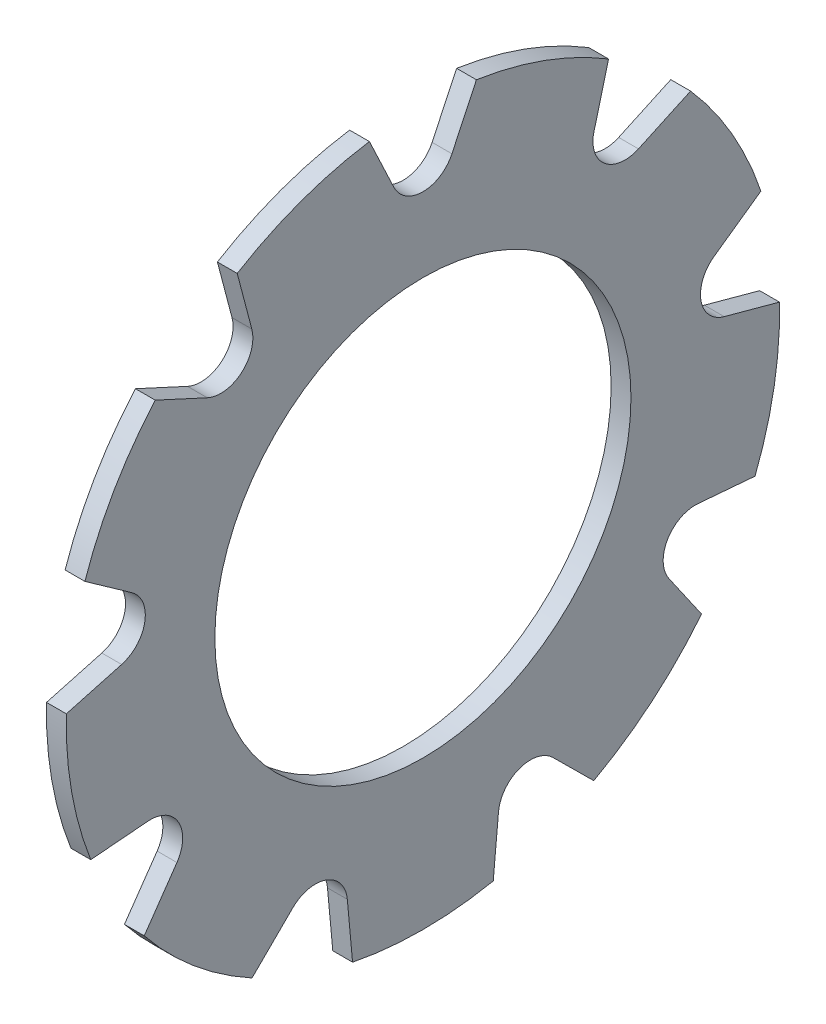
SolidWorks part; units mm, degrees
ref_plane "Plane1" through (0, 0, 0) normal (0, 0, 1) x (1, 0, 0)
ref_plane "Plane2" through (0, 0, 0) normal (0, 1, 0) x (1, 0, 0)
ref_plane "Plane3" through (0, 0, 0) normal (1, 0, 0) x (0, 0, -1)
sketch "Sketch1" plane through (0, 0, 0) normal (1, 0, 0) x (0, 0, -1)
  circle A0 centre (0, 0) radius 5.25
  circle A1 centre (0, 0) radius 9
  dimension "InsideDia" = 10.5
  dimension "OutsideDia" = 18
extrude "Base-Extrude" add sketch "Sketch1" against normal blind 0.5
sketch "Sketch3" plane through (0, 0, 0) normal (1, 0, 0) x (0, 0, -1)
  line L0 (0.7326, 7.5894) -> (1.35, 8.8982)
  line L1 (-0.7326, 7.5894) -> (-1.35, 8.8982)
  line L2 (-1.35, 8.8982) -> (-1.35, 9.7082)
  line L3 (-1.35, 9.7082) -> (1.35, 9.7082)
  line L4 (1.35, 9.7082) -> (1.35, 8.8982)
  arc A0 (-0.7326, 7.5894) -> (0.7326, 7.5894) centre (0, 7.935) ccw
  circle A1 centre (0, 0) radius 9 construction
  circle A2 centre (0, 0) radius 7.125 construction
  dimension "D1" = 1.62
  dimension "D4" = 14.25
  dimension "D2" = 2.7
  dimension "D3" = 0.81
  dimension "D5" = 1.35
extrude "TypeASlot" cut sketch "Sketch3" against normal through all
pattern_circular "TypeAPattern" count 9 over 360 about axis through (0, 0, 0) along (1, 0, 0) of "TypeASlot"
sketch "Sketch2" plane through (0, 0, 0) normal (1, 0, 0) x (0, 0, -1)
  line L0 (0.81, 0) -> (0.81, 6.315)
  line L1 (-0.81, 6.315) -> (-0.81, 0)
  line L2 (-0.81, 0) -> (0.81, 0)
  arc A0 (0.81, 6.315) -> (-0.81, 6.315) centre (0, 6.315) ccw
  circle A3 centre (0, 0) radius 7.125 construction
  dimension "D1" = 14.25
  dimension "SlotWidth" = 1.62
extrude "TypeJSlot" [suppressed] cut sketch "Sketch2" against normal through all
pattern_circular "TypeJPattern" [suppressed] count 9 over 360
equation "\"SlotWidth@Sketch2\" = \"OutsideDia@Sketch1\" * .09"
equation "\"D1@Sketch2\" = \"InsideDia@Sketch1\" +  ( \"OutsideDia@Sketch1\" - \"InsideDia@Sketch1\" )  / 2"
equation "\"D1@Sketch3\" = \"OutsideDia@Sketch1\" * .09"
equation "\"D2@Sketch3\" = \"OutsideDia@Sketch1\" * .15"
equation "\"D3@Sketch3\" = \"D1@Sketch3\" / 2"
equation "\"D4@Sketch3\" = \"InsideDia@Sketch1\" +  ( \"OutsideDia@Sketch1\" - \"InsideDia@Sketch1\" )  / 2"
equation "\"D5@Sketch3\" = \"D2@Sketch3\" / 2"
